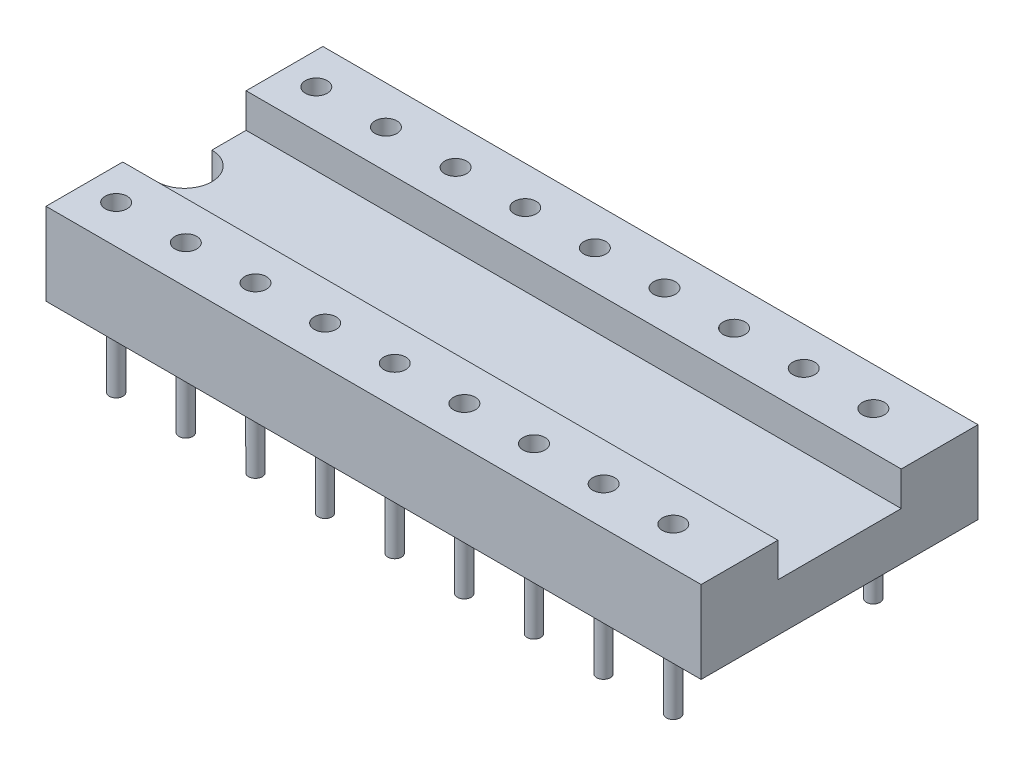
SolidWorks part; units mm, degrees
ref_plane "Plan de face" through (0, 0, 0) normal (0, 0, 1) x (1, 0, 0)
ref_plane "Plan de dessus" through (0, 0, 0) normal (0, 1, 0) x (1, 0, 0)
ref_plane "Plan de droite" through (0, 0, 0) normal (1, 0, 0) x (0, 0, -1)
sketch "Esquisse1" plane through (0, 0, 0) normal (1, 0, 0) x (0, 0, -1)
  line L0 (12.2051, 0) -> (-23.3437, 0) construction
  line L1 (0, -4.6214) -> (0, 25.9507) construction
  line L2 (-5.7968, 1.75) -> (2.763, 1.75) construction
  line L3 (5.7565, 3) -> (-6.8307, 3) construction
  line L4 (5.05, 3.8077) -> (5.05, -1.0493) construction
  line L5 (-5.05, 3.7235) -> (-5.05, -1.0493) construction
  line L6 (-2.25, 3.5071) -> (-2.25, 0.8142) construction
  line L7 (2.25, 3.5071) -> (2.25, 0.8142) construction
  line L8 (-2.25, 1.75) -> (-2.25, 3)
  line L9 (-2.25, 3) -> (-5.05, 3)
  line L10 (-5.05, 3) -> (-5.05, 0)
  line L11 (-5.05, 0) -> (5.05, 0)
  line L12 (5.05, 0) -> (5.05, 3)
  line L13 (5.05, 3) -> (2.25, 3)
  line L14 (2.25, 3) -> (2.25, 1.75)
  line L15 (2.25, 1.75) -> (-2.25, 1.75)
  dimension "D1" = 1.75
  dimension "D2" = 3
  dimension "D3" = 5.05
  dimension "D4" = 5.05
  dimension "D5" = 2.8
  dimension "D6" = 2.8
extrude "Extrusion1" add sketch "Esquisse1" along normal blind 23.9
sketch "Esquisse2" plane through (0, 1.75, 0) normal (0, 1, 0) x (-1, 0, 0)
  line L0 (0, -1) -> (0, 1)
  arc A0 (0, 1) -> (0, -1) centre (0, 0) ccw
extrude "Enlèv. mat.-Extru.1" cut sketch "Esquisse2" against normal through all
sketch "Esquisse3" plane through (0, 3, 0) normal (0, 1, 0) x (-1, 0, 0)
  line L0 (-13.1576, 5.05) -> (2.3638, 5.05) construction
  line L1 (0, 6.1465) -> (0, -6.3771) construction
  line L2 (1.5124, 0) -> (-12.9979, 0) construction
  line L3 (1.0512, 3.65) -> (-15.6055, 3.65) construction
  line L4 (-1.16, 6.2884) -> (-1.16, 1.7827) construction
  circle A0 centre (-1.16, 3.65) radius 0.4
  circle A1 centre (-1.16, -3.65) radius 0.4
  circle A2 centre (-3.701, 3.65) radius 0.4
  circle A3 centre (-3.701, -3.65) radius 0.4
  circle A4 centre (-6.242, 3.65) radius 0.4
  circle A5 centre (-6.242, -3.65) radius 0.4
  circle A6 centre (-8.783, 3.65) radius 0.4
  circle A7 centre (-8.783, -3.65) radius 0.4
  circle A8 centre (-11.323, 3.65) radius 0.4
  circle A9 centre (-11.323, -3.65) radius 0.4
  circle A10 centre (-13.863, 3.65) radius 0.4
  circle A11 centre (-13.863, -3.65) radius 0.4
  circle A12 centre (-16.403, 3.65) radius 0.4
  circle A13 centre (-16.403, -3.65) radius 0.4
  circle A14 centre (-18.943, 3.65) radius 0.4
  circle A15 centre (-18.943, -3.65) radius 0.4
  circle A16 centre (-21.483, 3.65) radius 0.4
  circle A17 centre (-21.483, -3.65) radius 0.4
  dimension "D1" = 1.4
  dimension "D2" = 1.16
extrude "Enlèv. mat.-Extru.2" cut sketch "Esquisse3" against normal blind 2.5
sketch "Esquisse5" plane through (0, 0, 0) normal (0, -1, 0) x (1, 0, 0)
  line L0 (-0.4263, 0) -> (10.6481, 0) construction
  circle A0 centre (1.16, 3.65) radius 0.25
  circle A1 centre (1.16, -3.65) radius 0.25
  circle A2 centre (3.7, -3.65) radius 0.25
  circle A3 centre (3.7, 3.65) radius 0.25
  circle A4 centre (6.24, -3.65) radius 0.25
  circle A5 centre (6.24, 3.65) radius 0.25
  circle A6 centre (8.78, -3.65) radius 0.25
  circle A7 centre (8.78, 3.65) radius 0.25
  circle A8 centre (11.32, -3.65) radius 0.25
  circle A9 centre (11.32, 3.65) radius 0.25
  circle A10 centre (13.86, -3.65) radius 0.25
  circle A11 centre (13.86, 3.65) radius 0.25
  circle A12 centre (16.4, -3.65) radius 0.25
  circle A13 centre (16.4, 3.65) radius 0.25
  circle A14 centre (18.94, -3.65) radius 0.25
  circle A15 centre (18.94, 3.65) radius 0.25
  circle A16 centre (21.48, 3.65) radius 0.25
  circle A17 centre (21.48, -3.65) radius 0.25
extrude "Extrusion2" add sketch "Esquisse5" along normal blind 3
